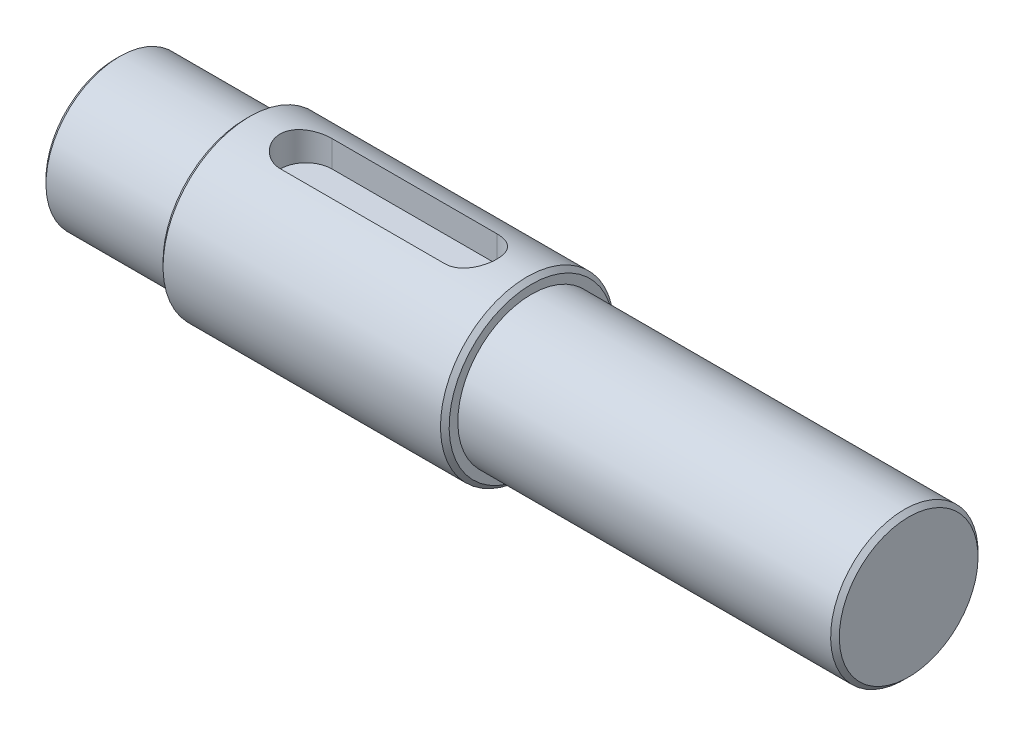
SolidWorks part; units mm, degrees
ref_plane "Front Plane" through (0, 0, 0) normal (0, 0, 1) x (1, 0, 0)
ref_plane "Top Plane" through (0, 0, 0) normal (0, 1, 0) x (1, 0, 0)
ref_plane "Right Plane" through (0, 0, 0) normal (1, 0, 0) x (0, 0, -1)
sketch "Sketch1" plane through (0, 0, 0) normal (0, 0, 1) x (1, 0, 0)
  line L0 (0, 0) -> (0, 8)
  line L1 (0.5, 8.5) -> (15, 8.5)
  line L2 (15, 8.5) -> (15, 9.5)
  line L3 (15.5, 10) -> (47.5, 10)
  line L4 (48, 9.5) -> (48, 8.5)
  line L5 (48, 8.5) -> (91, 8.5)
  line L6 (91.5, 8) -> (91.5, 0)
  line L7 (91.5, 0) -> (0, 0)
  line L8 (15, 9.5) -> (15.5, 10)
  line L9 (47.5, 10) -> (48, 9.5)
  line L10 (0, 8) -> (0.5, 8.5)
  line L11 (91, 8.5) -> (91.5, 8)
  point P1 (0, 8.5)
  point P5 (15, 10)
  point P6 (48, 10)
  point P8 (91.5, 8.5)
  dimension "D1" = 8.5
  dimension "D2" = 1.5
  dimension "D3" = 15
  dimension "D4" = 43.5
  dimension "D5" = 33
revolve "Revolve1" add sketch "Sketch1" angle 360 about L7
ref_plane "Plane1" through (0, 6.5, 0) normal (0, 1, 0) x (1, 0, 0)
sketch "Sketch2" plane through (0, 6.5, 0) normal (0, 1, 0) x (1, 0, 0)
  line L0 (22, 0) -> (41, 0) construction
  line L1 (22, 3) -> (41, 3)
  line L2 (22, -3) -> (41, -3)
  line L5 (15, 9.5) -> (15, -9.5) construction
  arc A0 (22, 3) -> (22, -3) centre (22, 0) ccw
  arc A1 (41, -3) -> (41, 3) centre (41, 0) ccw
  point P2 (31.5, 0)
  dimension "D1" = 19
  dimension "D2" = 6
  dimension "D3" = 16.5
extrude "Cut-Extrude1" cut sketch "Sketch2" along normal up to next
